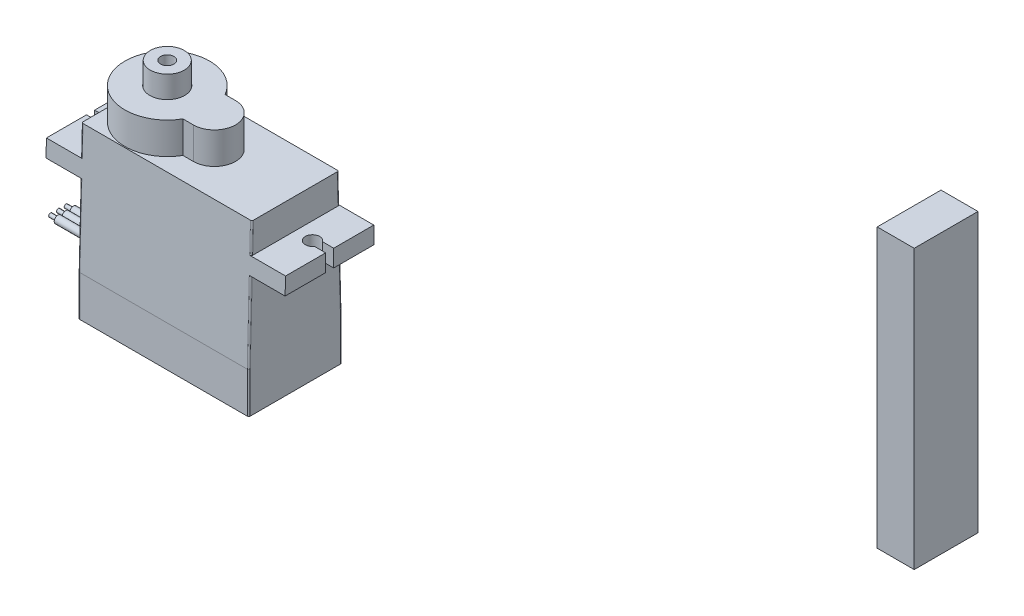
SolidWorks part; units mm, degrees
other "<Tower Pro 9g Micro Servo SG90>-<Boss-Extrude6>"
other "<Tower Pro 9g Micro Servo SG90>-<Cut-Extrude5>"
ref_plane "Front Plane" through (0, 0, 0) normal (0, 0, 1) x (1, 0, 0)
ref_plane "Top Plane" through (0, 0, 0) normal (0, 1, 0) x (1, 0, 0)
ref_plane "Right Plane" through (0, 0, 0) normal (1, 0, 0) x (0, 0, -1)
inserted part "Tower Pro 9g Micro Servo SG90"
sketch "Sketch1" plane through (0, 0, 0) normal (1, 0, 0) x (0, 0, -1)
  line L1 (0, 0) -> (8.6195, 0)
  line L2 (0, 0) -> (0, 37.6065)
  line L3 (0, 37.6065) -> (8.6195, 37.6065)
  line L4 (8.6195, 0) -> (8.6195, 37.6065)
extrude "Boss-Extrude1" add sketch "Sketch1" along normal blind 5 separate body
